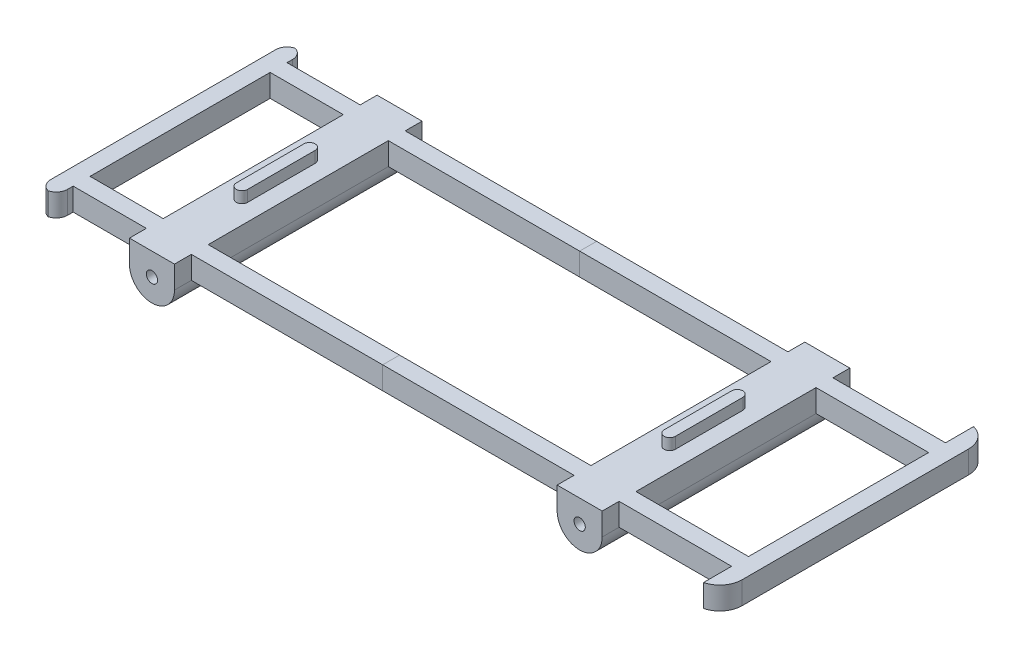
SolidWorks part; units mm, degrees
ref_plane "Front Plane" through (0, 0, 0) normal (0, 0, 1) x (1, 0, 0)
ref_plane "Top Plane" through (0, 0, 0) normal (0, 1, 0) x (1, 0, 0)
ref_plane "Right Plane" through (0, 0, 0) normal (1, 0, 0) x (0, 0, -1)
sketch "Sketch1" plane through (0, 0, 0) normal (0, 1, 0) x (1, 0, 0)
  line L0 (0, 0) -> (220, 0) construction
  line L1 (-117.3431, -80) -> (467.6569, -80)
  line L2 (-132.3431, -110) -> (-117.3431, -110)
  line L3 (-132.3431, -110) -> (-132.3431, 110)
  line L4 (-132.3431, 110) -> (-117.3431, 110)
  line L5 (-117.3431, -110) -> (-117.3431, 110)
  line L6 (467.6569, 120) -> (482.6569, 120)
  line L7 (467.6569, 120) -> (467.6569, -120)
  line L8 (467.6569, -120) -> (482.6569, -120)
  line L9 (482.6569, 120) -> (482.6569, -120)
  line L10 (-117.3431, 95) -> (467.6569, 95)
  line L11 (-117.3431, 95) -> (-117.3431, 80)
  line L12 (-117.3431, 80) -> (467.6569, 80)
  line L13 (467.6569, 95) -> (467.6569, 80)
  line L14 (467.6569, -95) -> (467.6569, -80)
  line L15 (-117.3431, -95) -> (-117.3431, -80)
  line L16 (-117.3431, -95) -> (467.6569, -95)
  dimension "D1" = 615
  dimension "D2" = 15
  dimension "D3" = 15
  dimension "D4" = 15
  dimension "D5" = 220
  dimension "D6" = 160
  dimension "D7" = 240
extrude "Boss-Extrude2" add sketch "Sketch1" along normal blind 20 contours L5 L12 L7 L10 | L5 L16 L7 L1 | L9 L6 L7 L8
sketch "Sketch3" plane through (0, 0, 0) normal (0, 0, 1) x (1, 0, 0)
  line L0 (-117.3431, 20) -> (467.6569, 20) construction
  line L1 (367.6569, 20) -> (327.6569, 20)
  line L2 (367.6569, 20) -> (367.6569, 0)
  line L4 (327.6569, 20) -> (327.6569, 0)
  line L5 (-117.3431, 0) -> (467.6569, 0) construction
  line L7 (-12.3431, 20) -> (-52.3431, 20)
  line L8 (-12.3431, 20) -> (-12.3431, 0)
  line L10 (-52.3431, 20) -> (-52.3431, 0)
  arc A0 (327.6569, 0) -> (367.6569, 0) centre (347.6569, 0) ccw
  arc A1 (-52.3431, 0) -> (-12.3431, 0) centre (-32.3431, 0) ccw
  dimension "D1" = 20
  dimension "D2" = 20
  dimension "D3" = 135
  dimension "D4" = 100
  dimension "D5" = 40
  dimension "D6" = 40
extrude "Boss-Extrude3" add sketch "Sketch3" along normal mid plane 220
sketch "Sketch4" plane through (0, 0, 0) normal (0, 0, 1) x (1, 0, 0)
  circle A0 centre (-32.3431, 0) radius 5
  circle A1 centre (347.6569, 0) radius 5
  dimension "D1" = 10
  dimension "D2" = 10
extrude "Cut-Extrude2" cut sketch "Sketch4" against normal mid plane 230
sketch "Sketch6" plane through (0, 20, 0) normal (0, 1, 0) x (1, 0, 0)
  line L0 (-132.3431, 0) -> (482.6569, 0) construction
  line L1 (-132.3431, -110) -> (-132.3431, 110) construction
  line L2 (482.6569, 120) -> (482.6569, -120) construction
  line L3 (-32.3431, -30) -> (-32.3431, 30) construction
  line L4 (-37.3431, -30) -> (-37.3431, 30)
  line L5 (-27.3431, -30) -> (-27.3431, 30)
  line L6 (347.6569, -30) -> (347.6569, 30) construction
  line L7 (342.6569, -30) -> (342.6569, 30)
  line L8 (352.6569, -30) -> (352.6569, 30)
  arc A0 (-37.3431, -30) -> (-27.3431, -30) centre (-32.3431, -30) ccw
  arc A1 (-27.3431, 30) -> (-37.3431, 30) centre (-32.3431, 30) ccw
  arc A2 (342.6569, -30) -> (352.6569, -30) centre (347.6569, -30) ccw
  arc A3 (352.6569, 30) -> (342.6569, 30) centre (347.6569, 30) ccw
  point P8 (-32.3431, 0)
  point P15 (347.6569, 0)
  dimension "D2" = 5
  dimension "D4" = 5
  dimension "D1" = 60
  dimension "D3" = 60
  dimension "D5" = 380
  dimension "D6" = 135
extrude "Boss-Extrude4" add sketch "Sketch6" along normal blind 10
fillet "Fillet1" radius 20 2 edges at (482.6569, 10, 120) (482.6569, 10, -120)
fillet "Fillet2" radius 10 4 edges at (-117.3431, 10, 110) (-132.3431, 10, 110) (-132.3431, 10, -110) (-117.3431, 10, -110)
sketch "Sketch7" plane through (0, 0, 0) normal (0, 1, 0) x (1, 0, 0)
  line L0 (157.6569, -95) -> (157.6569, 95)
  line L1 (-12.3431, -95) -> (327.6569, -95) construction
  line L2 (-12.3431, 95) -> (327.6569, 95) construction
split "Split1" trim tools "Sketch7" bodies to split 106 resulting bodies 107 108
